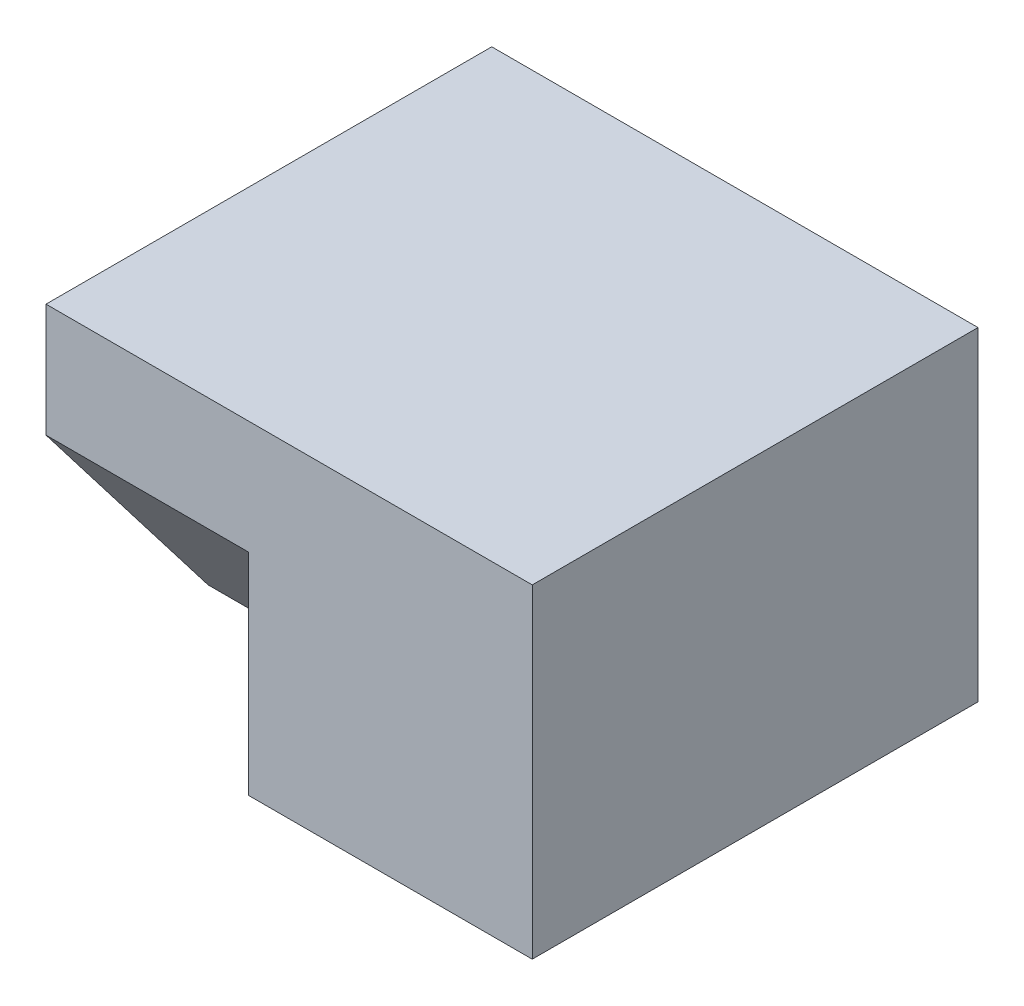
SolidWorks part; units mm, degrees
ref_plane "前视基准面" through (0, 0, 0) normal (0, 0, 1) x (1, 0, 0)
ref_plane "上视基准面" through (0, 0, 0) normal (0, 1, 0) x (1, 0, 0)
ref_plane "右视基准面" through (0, 0, 0) normal (1, 0, 0) x (0, 0, -1)
sketch "草图1" plane through (0, 0, 0) normal (0, 0, 1) x (1, 0, 0)
  line L1 (0, 0) -> (-60, 0)
  line L2 (0, 0) -> (0, 40)
  line L3 (0, 40) -> (-60, 40)
  line L4 (-60, 0) -> (-60, 40)
  dimension "D1" = 60
  dimension "D2" = 40
extrude "拉伸1" add sketch "草图1" along normal blind 55
sketch "草图3" plane through (-60, 0, 0) normal (-1, 0, 0) x (0, 0, 1)
  line L0 (55, 26) -> (55, 0)
  line L1 (55, 40) -> (55, 0) construction
  line L2 (55, 0) -> (35, 0)
  line L3 (55, 0) -> (0, 0) construction
  line L4 (35, 0) -> (55, 26)
  dimension "D1" = 26
  dimension "D2" = 20
extrude "切除-拉伸2" cut sketch "草图3" against normal blind 25
